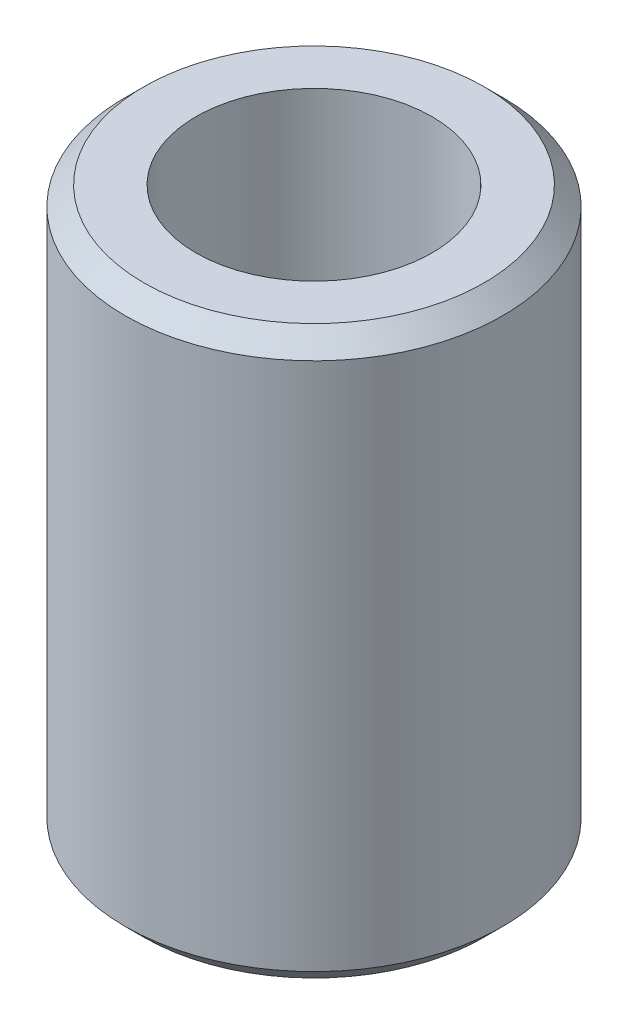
SolidWorks part; units mm, degrees
ref_plane "Front Plane" through (0, 0, 0) normal (0, 0, 1) x (1, 0, 0)
ref_plane "Top Plane" through (0, 0, 0) normal (0, 1, 0) x (1, 0, 0)
ref_plane "Right Plane" through (0, 0, 0) normal (1, 0, 0) x (0, 0, -1)
sketch "Sketch1" plane through (0, 0, 0) normal (0, 1, 0) x (1, 0, 0)
  circle A0 centre (0, 0) radius 20
  dimension "D1" = 40
extrude "Boss-Extrude1" add sketch "Sketch1" along normal blind 60
sketch "Sketch2" plane through (0, 60, 0) normal (0, 1, 0) x (1, 0, 0)
  circle A0 centre (0, 0) radius 12.5
  dimension "D1" = 25
extrude "Cut-Extrude1" cut sketch "Sketch2" against normal through all
chamfer "Chamfer1" distance 2 angle 45 2 edges at (0, 0, 20) (0, 60, 20)
